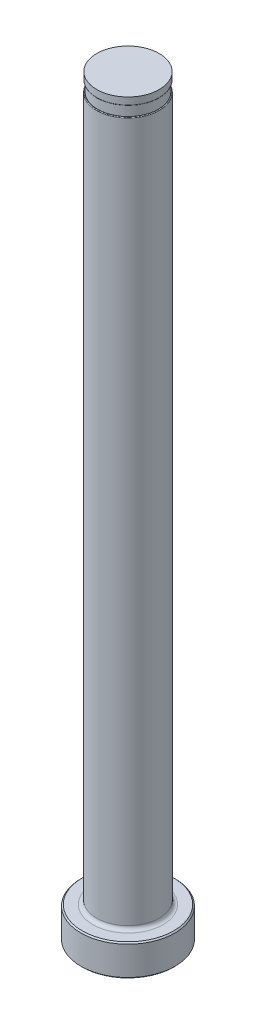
SolidWorks part; units mm, degrees
ref_plane "Front Plane" through (0, 0, 0) normal (0, 0, 1) x (1, 0, 0)
ref_plane "Top Plane" through (0, 0, 0) normal (0, 1, 0) x (1, 0, 0)
ref_plane "Right Plane" through (0, 0, 0) normal (1, 0, 0) x (0, 0, -1)
other "Configuration Table"
sketch "Sketch1" plane through (0, 0, 0) normal (0, 0, 1) x (1, 0, 0)
  line L0 (0, 259.9588) -> (0, -15.1925) construction
  line L1 (0, 0) -> (-9.525, 0)
  line L2 (-9.525, 0) -> (-9.525, 6.35)
  line L3 (-9.525, 6.35) -> (-6.35, 6.35)
  line L4 (-6.35, 6.35) -> (-6.35, 152.4)
  line L5 (-6.35, 152.4) -> (0, 152.4)
  line L6 (0, 152.4) -> (0, 0)
  dimension "L" = 152.4
  dimension "H" = 19.05
  dimension "T" = 6.35
  dimension "D" = 12.7
revolve "Revolve1" add sketch "Sketch1" angle 360 about L0
chamfer "Chamfer1" distance 0.254 angle 45 2 edges at (0, 6.35, 9.525) (0, 0, 9.525)
fillet "Fillet1" radius 0.762 1 edges at (0, 6.35, 6.35)
sketch "Sketch2" plane through (0, 0, 0) normal (0, 0, 1) x (1, 0, 0)
  line L0 (-6.35, 152.4) -> (-6.35, 7.112) construction
  line L1 (-6.35, 150.876) -> (-6.1468, 150.876)
  line L2 (-6.35, 150.876) -> (-6.35, 148.844)
  line L3 (-6.35, 148.844) -> (-6.1468, 148.844)
  line L4 (-6.1468, 150.876) -> (-6.1468, 148.844)
  line L5 (6.35, 152.4) -> (-6.35, 152.4) construction
  line L6 (0, 153.4483) -> (0, 147.3282) construction
  dimension "D1" = 2.032
  dimension "N" = 1.524
  dimension "FD" = 0.2032
  dimension "D3" = 12.2936
revolve "Vent Relief" cut sketch "Sketch2" angle 360 about L6
sketch "Sketch3" plane through (0, 0, 0) normal (0, 0, 1) x (1, 0, 0)
  line L0 (-6.1468, 149.86) -> (-6.1468, 86.36)
  line L1 (-6.1468, 150.876) -> (-6.1468, 148.844) construction
  line L2 (-6.35, 148.844) -> (-6.35, 7.112) construction
  line L3 (-6.35, 85.2424) -> (-6.35, 149.86)
  line L4 (-6.35, 149.86) -> (-6.1468, 149.86)
  arc A0 (-6.1468, 86.36) -> (-6.35, 85.2424) centre (-9.3218, 86.36) cw
  dimension "D1" = 3.175
  dimension "D2" = 63.5
extrude "D-Slot" cut sketch "Sketch3" against normal through all both and the other way through all
sketch "Sketch5" plane through (0, 0, 0) normal (0, 0, 1) x (1, 0, 0)
  line L0 (-6.35, 150.876) -> (6.35, 150.876) construction
  line L1 (-6.35, 152.4) -> (-6.3246, 152.4)
  line L2 (-6.35, 152.4) -> (-6.35, 150.876)
  line L3 (-6.35, 150.876) -> (-6.3246, 150.876)
  line L4 (-6.3246, 152.4) -> (-6.3246, 150.876)
  line L5 (0, 152.6877) -> (0, 150.5771) construction
  dimension "VP" = 0.0254
revolve "Vent Diameter" cut sketch "Sketch5" angle 360 about L5
fillet "Fillet2" radius 0.127 2 edges at (6.35, 148.844, 0) (0, 150.876, 6.3246)
sketch "Pocket Sketch" plane through (0, 0, 0) normal (0, 0, 1) x (1, 0, 0)
  line L0 (-9.9219, 0) -> (-9.9219, 6.3754)
  line L1 (-9.9219, 6.3754) -> (-7.3104, 6.3754)
  line L2 (-6.5484, 7.1374) -> (-6.5484, 22.225)
  line L3 (-6.5484, 22.225) -> (0, 22.225)
  line L4 (0, 22.225) -> (0, 0)
  line L5 (0, 0) -> (-9.9219, 0)
  line L6 (0, 12.6104) -> (0, -2.4989) construction
  line L7 (-9.525, 6.096) -> (-9.525, 0.254) construction
  line L8 (9.271, 6.35) -> (-9.271, 6.35) construction
  line L9 (-6.35, 85.2424) -> (-6.35, 7.112) construction
  line L10 (-7.3104, 6.3754) -> (-6.5484, 7.1374)
  point P3 (-6.5484, 6.3754)
  dimension "D1" = 19.8437
  dimension "D2" = 0.3969
  dimension "D3" = 0.0254
  dimension "D4" = 0.1984
  dimension "D5" = 13.0969
  dimension "D6" = 22.225
